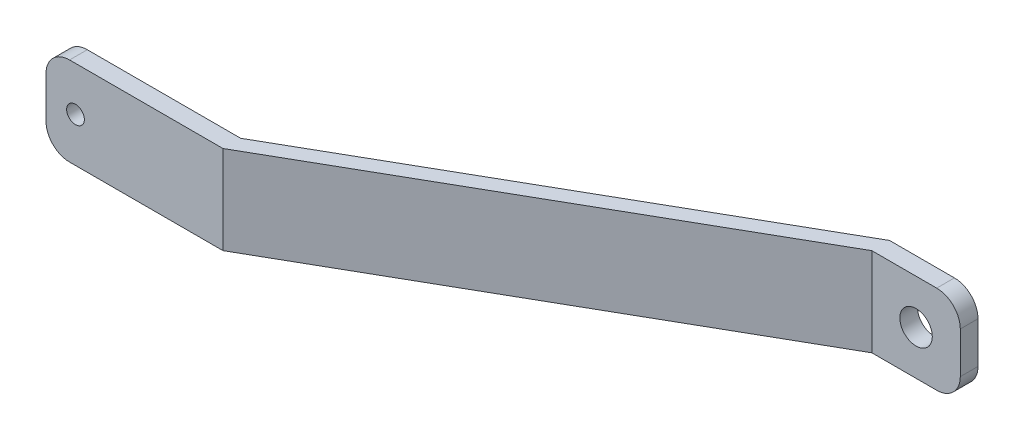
SolidWorks part; units mm, degrees
ref_plane "Front Plane" through (0, 0, 0) normal (0, 0, 1) x (1, 0, 0)
ref_plane "Top Plane" through (0, 0, 0) normal (0, 1, 0) x (1, 0, 0)
ref_plane "Right Plane" through (0, 0, 0) normal (1, 0, 0) x (0, 0, -1)
sketch "Sketch1" plane through (0, 0, 0) normal (0, 1, 0) x (1, 0, 0)
  line L0 (30, 3) -> (100, 43)
  line L1 (0, 0) -> (30, 0)
  line L2 (0, 0) -> (0, 3)
  line L3 (0, 3) -> (30, 3)
  line L4 (30, 0) -> (30, 3)
  line L5 (100, 43) -> (115, 43)
  line L6 (100, 43) -> (100, 40)
  line L7 (100, 40) -> (115, 40)
  line L8 (115, 43) -> (115, 40)
  line L9 (100, 40) -> (30, 0)
  dimension "D1" = 3
  dimension "D2" = 30
  dimension "D3" = 15
  dimension "D4" = 3
  dimension "D5" = 40
  dimension "D6" = 70
extrude "Boss-Extrude1" add sketch "Sketch1" along normal blind 15 contours L1 L4 L3 L2 | L9 L6 L0 L4 | L8 L5 L6 L7
sketch "Sketch2" plane through (0, 0, 0) normal (0, 0, 1) x (1, 0, 0)
  line L0 (115, 15) -> (115, 0) construction
  line L1 (0, 15) -> (0, 0) construction
  line L2 (0, 0) -> (30, 0) construction
  line L3 (100, 0) -> (115, 0) construction
  circle A0 centre (5, 7.5) radius 1.5
  circle A1 centre (107.5, 7.5) radius 2.75
  point P8 (0, 0)
  dimension "D1" = 3
  dimension "D2" = 5.5
  dimension "D3" = 7.5
  dimension "D4" = 5
  dimension "D5" = 7.5
  dimension "D6" = 7.5
extrude "Cut-Extrude1" cut sketch "Sketch2" against normal through all
fillet "Fillet1" radius 4 2 edges at (0, 0, -1.5) (0, 15, -1.5)
fillet "Fillet2" radius 4 2 edges at (115, 0, -41.5) (115, 15, -41.5)
